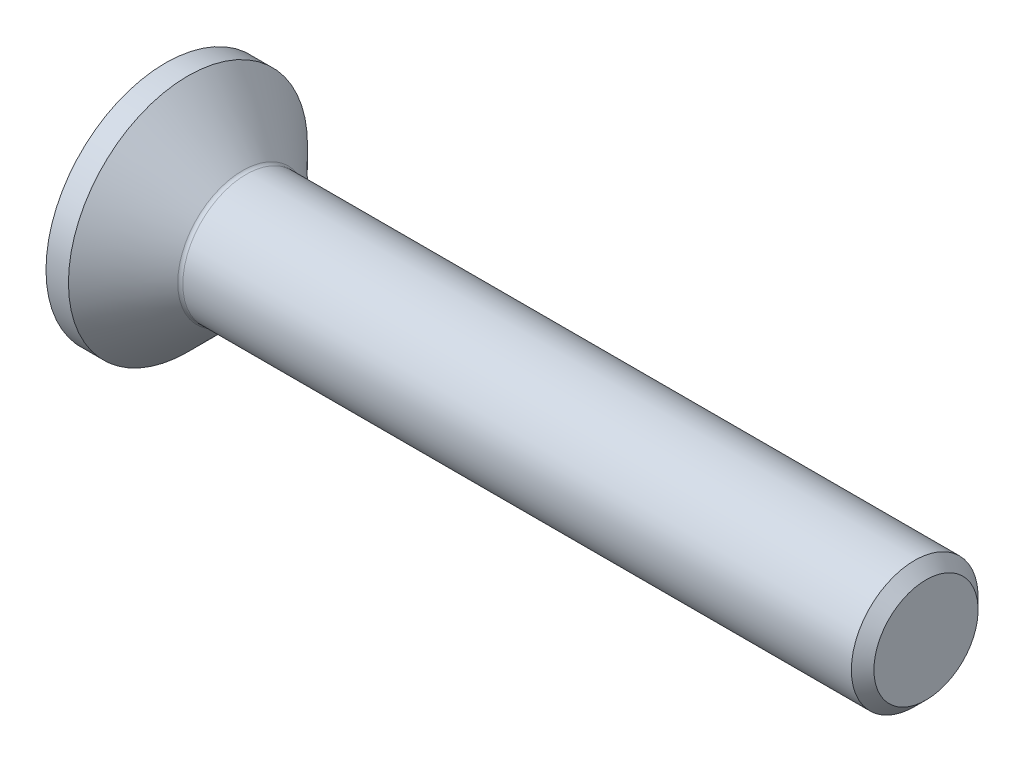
SolidWorks part; units mm, degrees
ref_plane "Plane1" through (0, 0, 0) normal (0, 0, 1) x (1, 0, 0)
ref_plane "Plane2" through (0, 0, 0) normal (0, 1, 0) x (1, 0, 0)
ref_plane "Plane3" through (0, 0, 0) normal (1, 0, 0) x (0, 0, -1)
sketch "BodySke" plane through (0, 0, 0) normal (0, 0, 1) x (1, 0, 0)
  line L0 (0, 0) -> (0, 4.715)
  line L1 (0.885, 4.715) -> (3.1, 2.5)
  line L2 (0, 4.715) -> (0.885, 4.715)
  line L3 (3.1, 2.5) -> (29.555, 2.5)
  line L4 (30, 2.055) -> (30, 0)
  line L5 (30, 0) -> (0, 0)
  line L6 (0, 0) -> (127, 0) construction
  line L7 (0.885, -4.715) -> (3.1, -2.5) construction
  line L8 (30, 2.055) -> (29.555, 2.5)
  line L9 (0, -4.715) -> (0.885, -4.715) construction
  line L10 (30, -2.055) -> (29.555, -2.5) construction
  line L11 (3.9, 8.85) -> (3.9, -13.375) construction
  line L12 (0, 19.05) -> (0, -3.175) construction
  dimension "D1" = 0.885
  dimension "Diameter" = 5
  dimension "Head_ht" = 3.1
  dimension "Length" = 30
  dimension "Body_ch_ang" = 45
  dimension "Head_dia" = 9.43
  dimension "Minor_dia" = 4.11
  dimension "Head_ang" = 90
  dimension "Advance" = 0.8
  dimension "Thread_nom" = 30
revolve "BaseBody" add sketch "BodySke"
fillet "Fillet1" radius 0.2 1 edges at (3.1, 0, 2.5)
sketch "Sketch2" plane through (0, 0, 0) normal (0, 0, 1) x (1, 0, 0)
  line L0 (0, 1.5) -> (1.9, 1.5)
  line L1 (1.9, 1.5) -> (2.766, 0)
  line L2 (0, 0) -> (127, 0) construction
  line L3 (2.766, 0) -> (0, 0)
  line L4 (0, 0) -> (0, 1.5)
  line L5 (0, -1.5) -> (1.9, -1.5) construction
  line L6 (0, 0) -> (47.625, 0) construction
  line L8 (0, 4.715) -> (0, -4.715) construction
  dimension "D2" = 60
  dimension "PreBroach_depth" = 1.9
  dimension "PreBroach_dia" = 3
revolve "PreBroach" cut sketch "Sketch2" angle 360 about L6
sketch "Sketch3" plane through (0, 0, 0) normal (-1, 0, 0) x (0, 0, 1)
  line L0 (-1.5, -0.866) -> (-1.5, 0.866)
  line L1 (-1.5, 0.866) -> (0, 1.7321)
  line L2 (0, 1.7321) -> (1.5, 0.866)
  line L3 (1.5, 0.866) -> (1.5, -0.866)
  line L4 (1.5, -0.866) -> (0, -1.7321)
  line L5 (0, -1.7321) -> (-1.5, -0.866)
  dimension "D1" = 1.5
  dimension "D2" = 1.5
  dimension "D3" = 3
  dimension "Hex_size" = 3
extrude "Hex" cut sketch "Sketch3" against normal blind 1.9
sketch "ThdSchSke" plane through (0, 0, 0) normal (0, 0, 1) x (1, 0, 0)
  line L0 (5.5, -2.055) -> (5.1884, -2.5)
  line L1 (5.5, -2.055) -> (5.8116, -2.5)
  line L2 (5.8116, -2.5) -> (5.8116, -3.125)
  line L3 (-3.175, 0) -> (5.1513, 0) construction
  line L4 (0, 4.715) -> (0, -4.715) construction
  line L5 (5.8116, -3.125) -> (5.1884, -3.125)
  line L6 (5.1884, -3.125) -> (5.1884, -2.5)
  dimension "Thread_minor" = 4.11
  dimension "Diameter" = 5
  dimension "Start" = 5.5
  dimension "SideAngle" = 55
  dimension "VeeAngle" = 70
  dimension "Overcut" = 6.25
revolve "ThreadSchematic" [suppressed] cut sketch "ThdSchSke" angle 360 about L3
pattern_linear "ThdSchPat" [suppressed]
equation "\"Thread_minor@ThreadCosmetic\"  =  \"Minor_dia@BodySke\""
equation "\"D1@Sketch3\" = \"Hex_size@Sketch3\" / 2"
equation "\"D2@Sketch3\" = \"D1@Sketch3\""
equation "\"D3@Sketch3\" = \"Hex_size@Sketch3\""
equation "\"Thread_length@ThreadCosmetic\" = ((sgn( (\"Length@BodySke\" - \"Advance@BodySke\" * 3.0 - \"Head_ht@BodySke\" ) - \"Thread_nom@BodySke\" )-1)*( (\"Length@BodySke\" - \"Advance@BodySke\" * 3.0 - \"Head_ht@BodySke\" "
equation "\"Thread_minor@ThdSchSke\" = \"Minor_dia@BodySke\""
equation "\"Diameter@ThdSchSke\" = \"Diameter@BodySke\""
equation "\"Overcut@ThdSchSke\" = \"Diameter@BodySke\" * 1.25"
equation "\"Start@ThdSchSke\" = 0.000001 + \"Length@BodySke\" - \"Thread_length@ThreadCosmetic\"  '---Countersunk---"
equation "\"Num_threads@ThdSchPat\" = int( \"Thread_length@ThreadCosmetic\" / \"Advance@BodySke\" + 0.999 )  + 1"
equation "\"Advance@ThdSchPat\" = \"Thread_length@ThreadCosmetic\" /  (\"Num_threads@ThdSchPat\" - 1) 'relax it"
equation "\"Num_threads@ThdSchPat\" = \"Num_threads@ThdSchPat\" - sgn( \"Num_threads@ThdSchPat\" - 1) '---chamfered tips only---"
